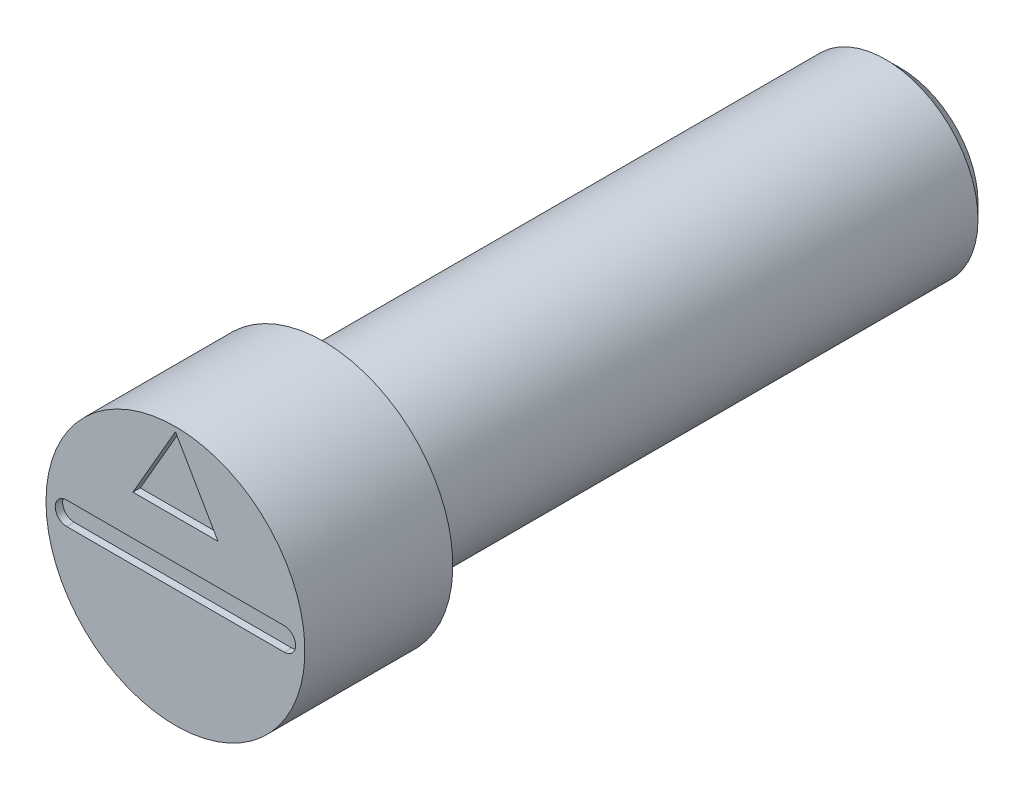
SolidWorks part; units mm, degrees
ref_plane "Front Plane" through (0, 0, 0) normal (0, 0, 1) x (1, 0, 0)
ref_plane "Top Plane" through (0, 0, 0) normal (0, 1, 0) x (1, 0, 0)
ref_plane "Right Plane" through (0, 0, 0) normal (1, 0, 0) x (0, 0, -1)
imported_body "Imported1"
other "DeleteFace1"
sketch "Sketch1" plane through (0, 0, 0) normal (0, 0, 1) x (1, 0, 0)
  line L0 (0, 1.6909) -> (-0.575, 0.695)
  line L1 (-0.575, 0.695) -> (0.575, 0.695)
  line L2 (0.575, 0.695) -> (0, 1.6909)
  line L4 (-1.47, 0.155) -> (1.47, 0.155)
  line L6 (-1.47, -0.155) -> (1.47, -0.155)
  arc A0 (-1.47, 0.155) -> (-1.47, -0.155) centre (-1.47, 0) ccw
  arc A1 (1.47, -0.155) -> (1.47, 0.155) centre (1.47, 0) ccw
  dimension "D6" = 3.25
  dimension "D7" = 1.625
  dimension "D1" = 1.15
  dimension "D2" = 60
  dimension "D3" = 60
  dimension "D4" = 0.31
  dimension "D5" = 0.155
  dimension "D8" = 0.54
extrude "Cut-Extrude1" cut sketch "Sketch1" against normal blind 0.1
sketch "Sketch2" plane through (0, 0, -15) normal (0, 0, -1) x (-1, 0, 0)
  circle A1 centre (0, 0) radius 1.25
  circle A2 centre (0, 0) radius 1.25
  dimension "D1" = 0
extrude "Cut-Extrude2" cut sketch "Sketch2" against normal offset from surface (5.2 mm away) 9.8
chamfer "Chamfer1" distance 0.2 angle 45 1 edges at (1.25, 0, -9.8)
